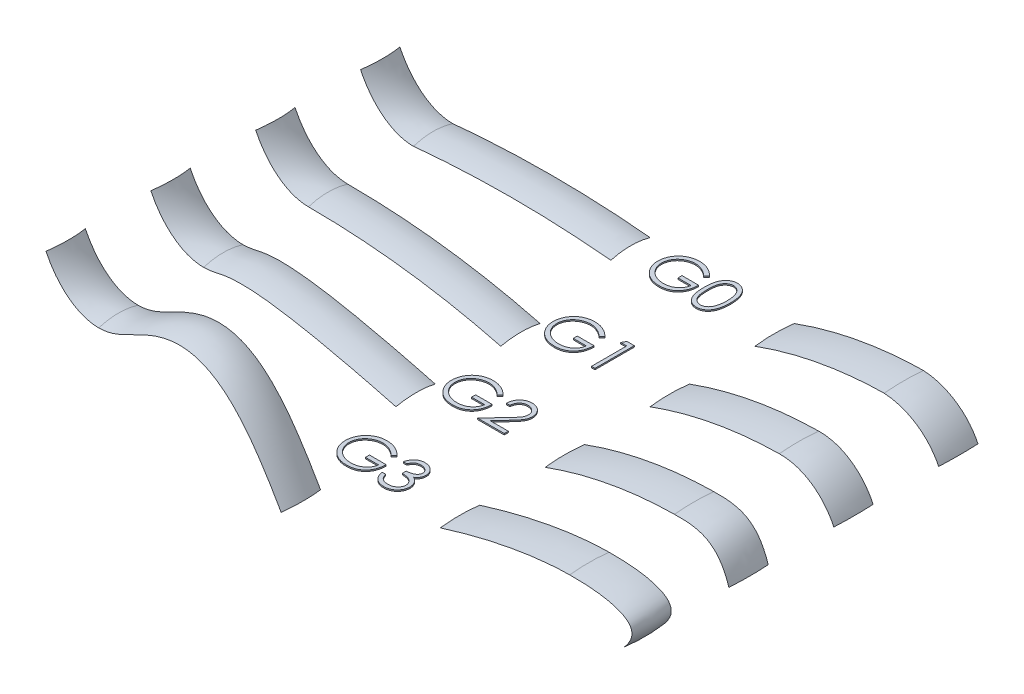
SolidWorks part; units mm, degrees
ref_plane "Front Plane" through (0, 0, 0) normal (0, 0, 1) x (1, 0, 0)
ref_plane "Top Plane" through (0, 0, 0) normal (0, 1, 0) x (1, 0, 0)
ref_plane "Right Plane" through (0, 0, 0) normal (1, 0, 0) x (0, 0, -1)
sketch "Sketch1"
ref_plane "Plane1" through (0, 0, 203.2) normal (0, 0, 1) x (1, 0, 0)
ref_plane "Plane2" through (0, 0, 406.4) normal (0, 0, 1) x (1, 0, 0)
ref_plane "Plane3" through (0, 0, 609.6) normal (0, 0, 1) x (1, 0, 0)
sketch "Sketch2"
sketch "Sketch3" plane through (0, 0, 406.4) normal (0, 0, 1) x (1, 0, 0)
  spline S0 degree 3 poles (-32.0351, 1973.3734) (883.5706, -2049.6829) (-1733.7751, 1607.3045) (1805.1736, -49.4486) knots -3.630732 -3.630732 -3.630732 -3.630732 5.63783 5.63783 5.63783 5.63783 only from (0, 0) to (-96.9598, 74.1299) construction
  spline S1 degree 3 poles (0, 0) (-39.4327, 0) (-75.809, 30.1497) (-96.9598, 74.1299) knots 0 0 0 0 1 1 1 1
  spline S2 degree 3 poles (0, 0) (44.842, 0) (46.0275, 38.9887) (374.1236, -47.8024) knots 0 0 0 0 1 1 1 1
sketch "Sketch4" plane through (0, 0, 609.6) normal (0, 0, 1) x (1, 0, 0)
  line L0 (0, 0) -> (64.9705, 0) construction
  line L1 (64.9705, 0) -> (97.3113, 68.2057) construction
  line L2 (97.3113, 68.2057) -> (205.4179, 89.5655) construction
  line L3 (205.4179, 89.5655) -> (265.1381, 27.6657) construction
  line L4 (265.1381, 27.6657) -> (358.609, -135.8389) construction
  spline S1 degree 3 poles (0, 0) (-39.4327, 0) (-75.809, 30.1497) (-96.9598, 74.1299) knots 0 0 0 0 1 1 1 1
  spline_without_curve S2
ref_plane "Plane4" through (-96.9598, 74.1299, 0) normal (-0.4334, 0.9012, 0) x (0.9012, 0.4334, 0)
sketch "Sketch5" plane through (-96.9598, 74.1299, 0) normal (-0.4334, 0.9012, 0) x (0.9012, 0.4334, 0)
  arc A0 (-5.8497, -38.1) -> (-5.8497, 38.1) centre (-127, 0) ccw
  point P5 (0, 0)
  dimension "D2" = 127
  dimension "D1" = 76.2
sketch "Sketch6" plane through (-96.9598, 74.1299, 203.2) normal (-0.4334, 0.9012, 0) x (0.9012, 0.4334, 0)
  arc A0 (-5.8497, -38.1) -> (-5.8497, 38.1) centre (-127, 0) ccw
sketch "Sketch7" plane through (-96.9598, 74.1299, 406.4) normal (-0.4334, 0.9012, 0) x (0.9012, 0.4334, 0)
  arc A0 (-5.8497, -38.1) -> (-5.8497, 38.1) centre (-127, 0) ccw
sketch "Sketch9" plane through (-96.9598, 74.1299, 609.6) normal (-0.4334, 0.9012, 0) x (0.9012, 0.4334, 0)
  arc A0 (-5.8497, -38.1) -> (-5.8497, 38.1) centre (-127, 0) ccw
surface "G3"
surface "G2"
surface "G1"
surface "G0"
sketch "Sketch10" plane through (0, 0, 0) normal (0, 1, 0) x (1, 0, 0)
  text T0 "G0" font "Century Gothic" height 76.2
  text T1 "G1" font "Century Gothic" height 76.2
  text T2 "G3" font "Century Gothic" height 76.2
  text T3 "G2" font "Century Gothic" height 76.2
extrude "Boss-Extrude1" add sketch "Sketch10" along normal blind 2.54
sketch "Esquisse1"
  dimension "D2" = 127
ref_plane "Plan1" through (661.2989, -8.6504, 0) normal (0.9389, 0.3443, 0) x (0, 0, -1)
sketch "Esquisse2" plane through (661.2989, -8.6504, 0) normal (0.9389, 0.3443, 0) x (0, 0, -1)
  line L0 (-38.1, 230.2208) -> (-38.1, 98.5785) construction
  line L1 (38.1, 98.5785) -> (38.1, 230.2208) construction
  arc A0 (-38.1, -1.8945) -> (38.1, -1.8945) centre (0, -384.055) cw
surface "G0 -2"
sketch "Esquisse3"
sketch "Esquisse5" plane through (661.2989, -8.6504, 203.2) normal (0.9389, 0.3443, 0) x (0, 0, -1)
  arc A0 (-38.1, -1.8945) -> (38.1, -1.8945) centre (0, -384.055) cw
surface "G1 -2"
sketch "Esquisse6"
sketch "Esquisse7" plane through (661.2989, -8.6504, 406.4) normal (0.9389, 0.3443, 0) x (0, 0, -1)
  arc A0 (-38.1, -1.8945) -> (38.1, -1.8945) centre (0, -384.055) cw
surface "G2 -2"
sketch "Esquisse8" plane through (0, 0, 609.6) normal (0, 0, 1) x (1, 0, 0)
  spline S0 degree 3 poles (661.2989, -8.6504) (757.4117, 21.3797) (841.1262, 36.8824) (912.4424, 37.8577) knots 0 0 0 0 1 1 1 1
  spline S1 degree 3 poles (912.4424, 37.8577) (992.7453, 38.9559) (1068.4393, 21.7868) (1019.7606, -33.4502) knots 0 0 0 0 1 1 1 1
sketch "Esquisse10" plane through (661.2989, -8.6504, 609.6) normal (0.9389, 0.3443, 0) x (0, 0, -1)
  arc A0 (-38.1, -1.8945) -> (38.1, -1.8945) centre (0, -384.055) cw
surface "G3 -2"
ref_plane "Plan2" through (0, 0, 812.8) normal (0, 0, 1) x (1, 0, 0)
sketch "Esquisse12" plane through (0, 0, 812.8) normal (0, 0, 1) x (1, 0, 0)
  line L1 (661.2989, -8.6504) -> (661.9512, -10.4291) construction
  arc A2 (912.4424, 37.8577) -> (661.2989, -8.6504) centre (923.6601, -724.0597) ccw construction
  spline S0 degree 3 poles (665.5871, -20.3436) (731.6862, 6.467) (795.9329, 26.0683) (856.4685, 34.8236) (859.4826, 35.2329) knots 0 0 0 0 0.95 1 1 1 1
  spline S1 degree 3 poles (859.4826, 35.2329) (973.2765, 50.6834) (1004.379, 16.7066) (1019.7577, -33.4411) knots 0 0 0 0 1 1 1 1
sketch "Esquisse13" plane through (665.5871, -20.3436, 812.8) normal (0.9389, 0.3443, 0) x (0, 0, -1)
  arc A0 (-38.1, -1.8945) -> (38.1, -1.8945) centre (0, -384.055) cw
surface "Surface-Balayage1"
